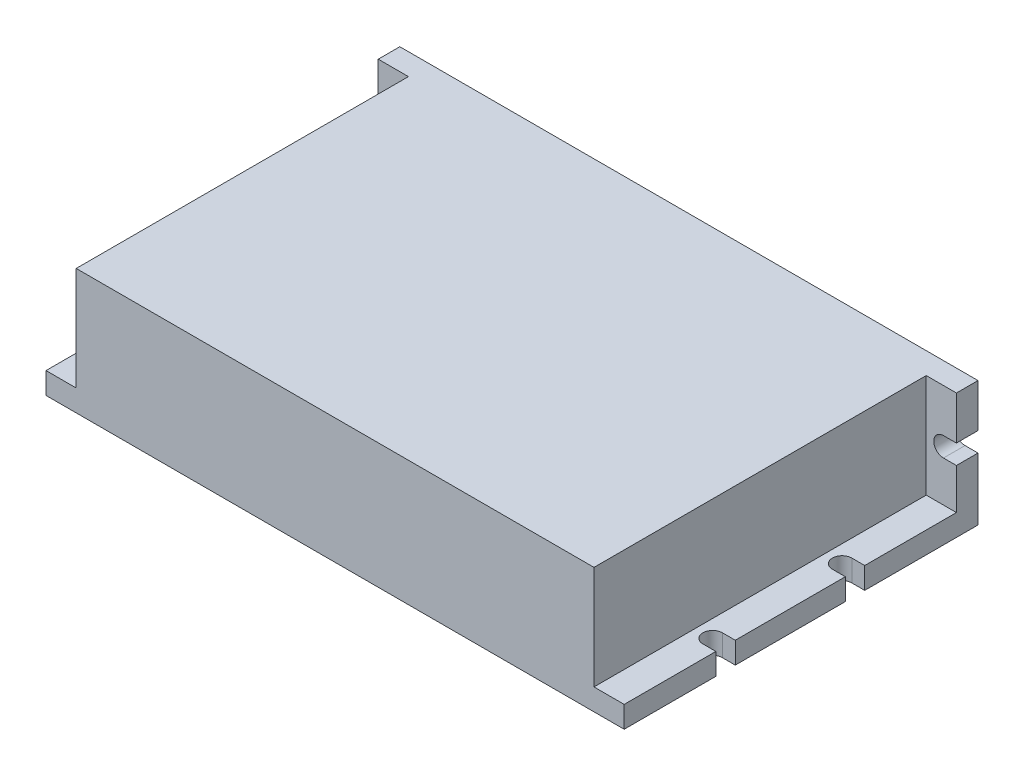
SolidWorks part; units mm, degrees
ref_plane "前视" through (0, 0, 0) normal (0, 0, 1) x (1, 0, 0)
ref_plane "上视" through (0, 0, 0) normal (0, 1, 0) x (1, 0, 0)
ref_plane "右视" through (0, 0, 0) normal (1, 0, 0) x (0, 0, -1)
sketch "草图1" plane through (0, 0, 0) normal (0, 1, 0) x (1, 0, 0)
  line L1 (0, 0) -> (134, 0)
  line L2 (0, 0) -> (0, 82)
  line L3 (0, 82) -> (134, 82)
  line L4 (134, 0) -> (134, 82)
extrude "凸台-拉伸1" add sketch "草图1" along normal blind 29
sketch "草图2" plane through (0, 0, 0) normal (0, 0, 1) x (1, 0, 0)
  line L1 (0, 29) -> (7, 29)
  line L2 (0, 29) -> (0, 5)
  line L3 (0, 5) -> (7, 5)
  line L4 (7, 29) -> (7, 5)
  line L5 (134, 29) -> (127, 29)
  line L6 (134, 29) -> (134, 5)
  line L7 (134, 5) -> (127, 5)
  line L8 (127, 29) -> (127, 5)
extrude "切除-拉伸1" cut sketch "草图2" against normal blind 77
ref_plane "基准面1" through (0, 0, -77) normal (0, 0, 1) x (1, 0, 0)
sketch "草图3" plane through (0, 0, -77) normal (0, 0, 1) x (1, 0, 0)
  line L0 (131, 18.95) -> (134, 18.95)
  line L2 (134, 5) -> (134, 29) construction
  line L3 (134, 18.95) -> (134, 14.45)
  line L4 (134, 14.45) -> (131, 14.45)
  line L5 (3, 18.95) -> (0, 18.95)
  line L7 (0, 29) -> (0, 5) construction
  line L8 (0, 18.95) -> (0, 14.45)
  line L9 (0, 14.45) -> (3, 14.45)
  arc A0 (131, 18.95) -> (131, 14.45) centre (131, 16.7) ccw
  arc A1 (3, 18.95) -> (3, 14.45) centre (3, 16.7) cw
extrude "切除-拉伸2" cut sketch "草图3" against normal blind 52
ref_plane "基准面2" through (0, 5, 0) normal (0, 1, 0) x (1, 0, 0)
sketch "草图4" plane through (0, 5, 0) normal (0, 1, 0) x (1, 0, 0)
  line L1 (0, 77) -> (0, 0) construction
  line L3 (3, 25.75) -> (0, 25.75)
  line L4 (3, 55.75) -> (0, 55.75)
  line L5 (0, 55.75) -> (0, 51.25)
  line L6 (134, 77) -> (134, 0) construction
  line L7 (0, 51.25) -> (3, 51.25)
  line L8 (0, 25.75) -> (0, 21.25)
  line L10 (131, 55.75) -> (134, 55.75)
  line L11 (134, 55.75) -> (134, 51.25)
  line L12 (134, 51.25) -> (131, 51.25)
  line L13 (131, 25.75) -> (134, 25.75)
  line L14 (134, 25.75) -> (134, 21.25)
  line L15 (134, 21.25) -> (131, 21.25)
  line L16 (0, 21.25) -> (3, 21.25)
  arc A0 (131, 55.75) -> (131, 51.25) centre (131, 53.5) ccw
  arc A1 (131, 25.75) -> (131, 21.25) centre (131, 23.5) ccw
  arc A2 (3, 55.75) -> (3, 51.25) centre (3, 53.5) cw
  arc A3 (3, 25.75) -> (3, 21.25) centre (3, 23.5) cw
extrude "切除-拉伸3" cut sketch "草图4" against normal blind 5
